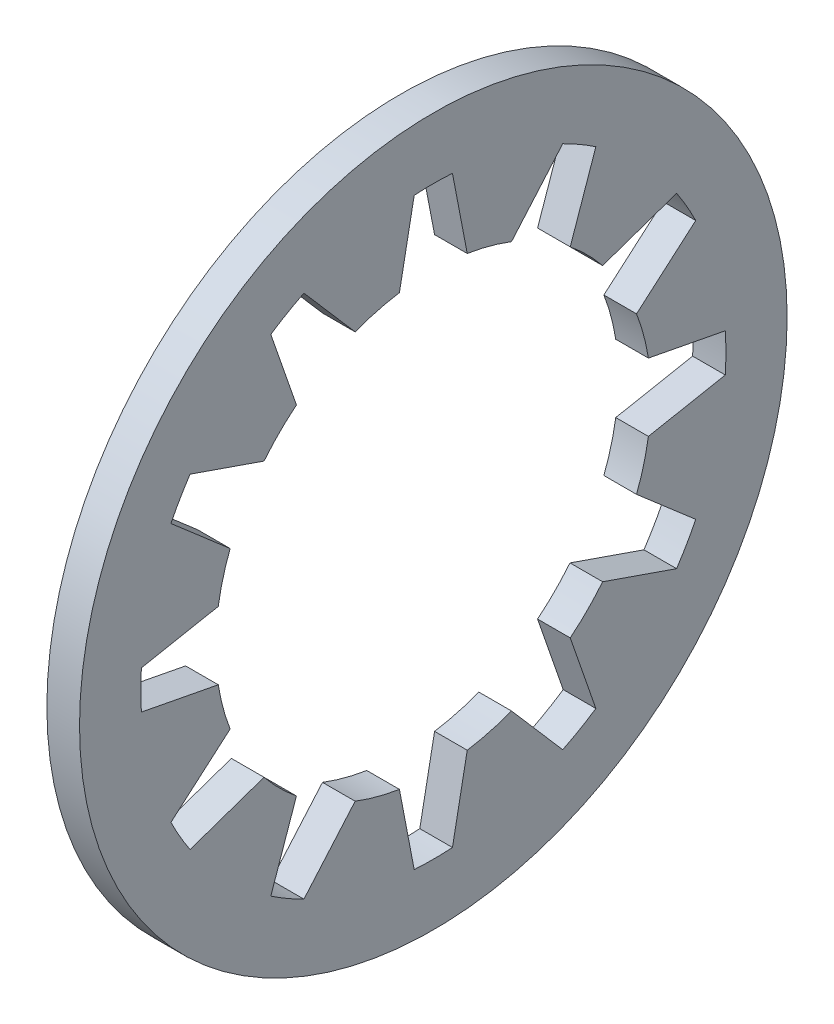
SolidWorks part; units mm, degrees
ref_plane "Plane1" through (0, 0, 0) normal (0, 0, 1) x (1, 0, 0)
ref_plane "Plane2" through (0, 0, 0) normal (0, 1, 0) x (1, 0, 0)
ref_plane "Plane3" through (0, 0, 0) normal (1, 0, 0) x (0, 0, -1)
sketch "SecSke" plane through (0, 0, 0) normal (0, 0, 1) x (1, 0, 0)
  line L0 (-34.925, 0) -> (9.525, 0) construction
  line L1 (0, 8) -> (0, 13)
  line L2 (0, 13) -> (-1.2, 13)
  line L3 (-1.2, 13) -> (-1.2, 8)
  line L4 (-1.2, 8) -> (0, 8)
  dimension "Thickness" = 1.2
  dimension "Inside_dia" = 16
  dimension "Outside_dia" = 26
revolve "Body" add sketch "SecSke" angle 360 about L0
sketch "IntCutSke" plane through (0, 0, 0) normal (1, 0, 0) x (0, 0, -1)
  line L0 (-0.7031, 10.727) -> (-1.3263, 7.4834)
  line L1 (0.7031, 10.727) -> (1.3263, 7.4834)
  line L2 (0, 0) -> (0, 10.75) construction
  arc A0 (1.3263, 7.4834) -> (-1.3263, 7.4834) centre (0, 0) ccw
  arc A1 (0.7031, 10.727) -> (-0.7031, 10.727) centre (0, 0) ccw
  dimension "cut_dia" = 21.5
  dimension "Clr_dia" = 15.2
  dimension "Clr_ang" = 20.1
  dimension "Cut_ang" = 7.5
extrude "IntCut" cut sketch "IntCutSke" against normal through all
pattern_circular "IntCuts" count 12 every 30 about axis through (-34.925, 0, 0) along (1, 0, 0) of "IntCut"
equation "' \"Inside_dia@SecSke\" = 16"
equation "' \"Outside_dia@SecSke\" = 26"
equation "' \"Thickness@SecSke\" = 1.2"
equation "' \"Count@IntCuts\" = 12"
equation "' \"Inside_dia@SecSke\" = 10.5"
equation "' \"Outside_dia@SecSke\" = 18"
equation "' \"Thickness@SecSke\" = 0.9"
equation "' \"Count@IntCuts\" = 9"
equation "' \"Inside_dia@SecSke\" = 6.4"
equation "' \"Outside_dia@SecSke\" = 11"
equation "' \"Thickness@SecSke\" = 0.6"
equation "' \"Inside_dia@SecSke\" = 4.3"
equation "' \"Outside_dia@SecSke\" = 8.5"
equation "' \"Thickness@SecSke\" = 0.45"
equation "' \"Count@IntCuts\" = 8"
equation "\"Angle@IntCuts\" = 360 / \"Count@IntCuts\""
equation "\"Clr_dia@IntCutSke\" =  \"Inside_dia@SecSke\" * 0.95"
equation "\"Cut_dia@IntCutSke\" = \"Inside_dia@SecSke\" + (\"Outside_dia@SecSke\"  - \"Inside_dia@SecSke\" ) * 0.55"
equation "\"Clr_ang@IntCutSke\" = (360 / \"Count@IntCuts\") * 0.67"
equation "\"Cut_ang@IntCutSke\" = (360 / \"Count@IntCuts\") * 0.25"
